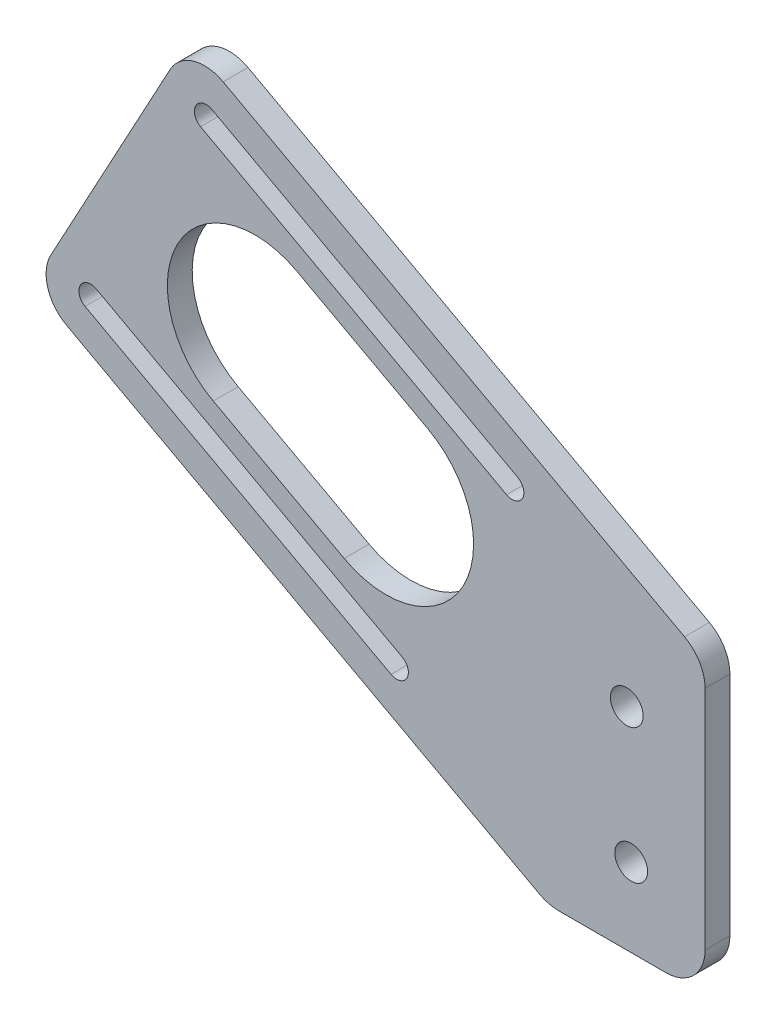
SolidWorks part; units mm, degrees
ref_plane "Front Plane" through (0, 0, 0) normal (0, 0, 1) x (1, 0, 0)
ref_plane "Top Plane" through (0, 0, 0) normal (0, 1, 0) x (1, 0, 0)
ref_plane "Right Plane" through (0, 0, 0) normal (1, 0, 0) x (0, 0, -1)
sketch "Sketch1" plane through (0, 0, 0) normal (0, 0, 1) x (1, 0, 0)
  line L0 (-9.5, 280) -> (-10, 280) construction
  line L1 (-10, 0) -> (-10, 280) construction
  line L2 (10, 280) -> (9.5, 280) construction
  line L3 (9.5, 280) -> (2.88, 280) construction
  line L4 (-9.5, 280) -> (-10, 280) construction
  line L5 (-10, 0) -> (-10, 280) construction
  line L6 (10, 280) -> (9.5, 280) construction
  line L7 (9.5, 280) -> (2.88, 280) construction
  line L8 (-10, 243.0676) -> (10, 280)
  line L9 (10, 280) -> (-10, 280)
  line L10 (10, 280) -> (10, 243.0676)
  line L11 (10, 243.0676) -> (-10, 243.0676)
  line L12 (-10, 280) -> (-10, 243.0676)
  line L13 (-10, 243.0676) -> (-75.9507, 278.7819)
  line L14 (10, 280) -> (-55.9507, 315.7143)
  line L15 (-75.9507, 278.7819) -> (-55.9507, 315.7143)
  line L16 (-10, 243.0676) -> (-55.9507, 315.7143) construction
  line L17 (10, 280) -> (-75.9507, 278.7819) construction
  line L18 (-39.0183, 258.7819) -> (-19.0183, 295.7143) construction
  circle A0 centre (0, 270) radius 2.095 construction
  circle A1 centre (0, 270) radius 2.095
  circle A2 centre (0.5697, 253.0676) radius 2.095
  point P12 (-32.9753, 279.391)
  dimension "D3" = 10
  dimension "D4" = 4.19
  dimension "D5" = 9.4303
  dimension "D1" = 42
  dimension "D2" = 42
  dimension "D6" = 75
extrude "Boss-Extrude1" add sketch "Sketch1" along normal blind 3.175 contours L9 L12 L8 A1 | L11 L10 L8 A2 | L15 L13 L12 L9 L14
sketch "Sketch2" plane through (0, 0, 0) normal (0, 0, -1) x (-1, 0, 0)
  line L0 (53.7277, 308.2498) -> (14.6409, 287.0831) construction
  line L1 (54.442, 306.9307) -> (15.3552, 285.7641)
  line L2 (53.0134, 309.5688) -> (13.9266, 288.4021)
  line L3 (65.9507, 297.2481) -> (47.4845, 287.2481) construction
  line L4 (75.9507, 278.7819) -> (55.9507, 315.7143) construction
  line L5 (68.4845, 280.9995) -> (29.3978, 259.8328) construction
  line L6 (67.7702, 282.3185) -> (28.6835, 261.1518)
  line L7 (69.1988, 279.6805) -> (30.112, 258.5138)
  line L8 (47.4845, 287.2481) -> (30.7635, 278.1932) construction
  line L9 (52.8178, 277.3995) -> (36.0968, 268.3446)
  line L10 (42.1511, 297.0967) -> (25.4302, 288.0418)
  line L14 (10, 243.0676) -> (75.9507, 278.7819) construction
  line L15 (-10, 280) -> (55.9507, 315.7143) construction
  circle A6 centre (47.4845, 287.2481) radius 11.2 construction
  circle A9 centre (53.7277, 308.2498) radius 1.5 construction
  arc A10 (54.442, 306.9307) -> (53.0134, 309.5688) centre (53.7277, 308.2498) ccw
  arc A11 (13.9266, 288.4021) -> (15.3552, 285.7641) centre (14.6409, 287.0831) ccw
  arc A12 (67.7702, 282.3185) -> (69.1988, 279.6805) centre (68.4845, 280.9995) cw
  arc A13 (30.112, 258.5138) -> (28.6835, 261.1518) centre (29.3978, 259.8328) cw
  arc A14 (52.8178, 277.3995) -> (42.1511, 297.0967) centre (47.4845, 287.2481) ccw
  arc A15 (25.4302, 288.0418) -> (36.0968, 268.3446) centre (30.7635, 278.1932) ccw
  point P15 (34.1843, 297.6664)
  point P26 (48.9411, 270.4161)
  point P31 (39.124, 282.7206)
  dimension "D4" = 21
  dimension "D6" = 11.2
  dimension "D8" = 1.5
  dimension "D10" = 5.5093
  dimension "D1" = 44.45
  dimension "D2" = 5.5053
  dimension "D3" = 19.0153
  dimension "D5" = 19.0153
extrude "Cut-Extrude1" cut sketch "Sketch2" against normal through all contours L10 A15 L9 A14 | L2 A11 L1 A10 | L6 A13 L7 A12
fillet "Fillet1" radius 5 5 edges at (10, 280, 1.5875) (10, 243.0676, 1.5875) (-10, 243.0676, 1.5875) (-75.9507, 278.7819, 1.5875) (-55.9507, 315.7143, 1.5875)
